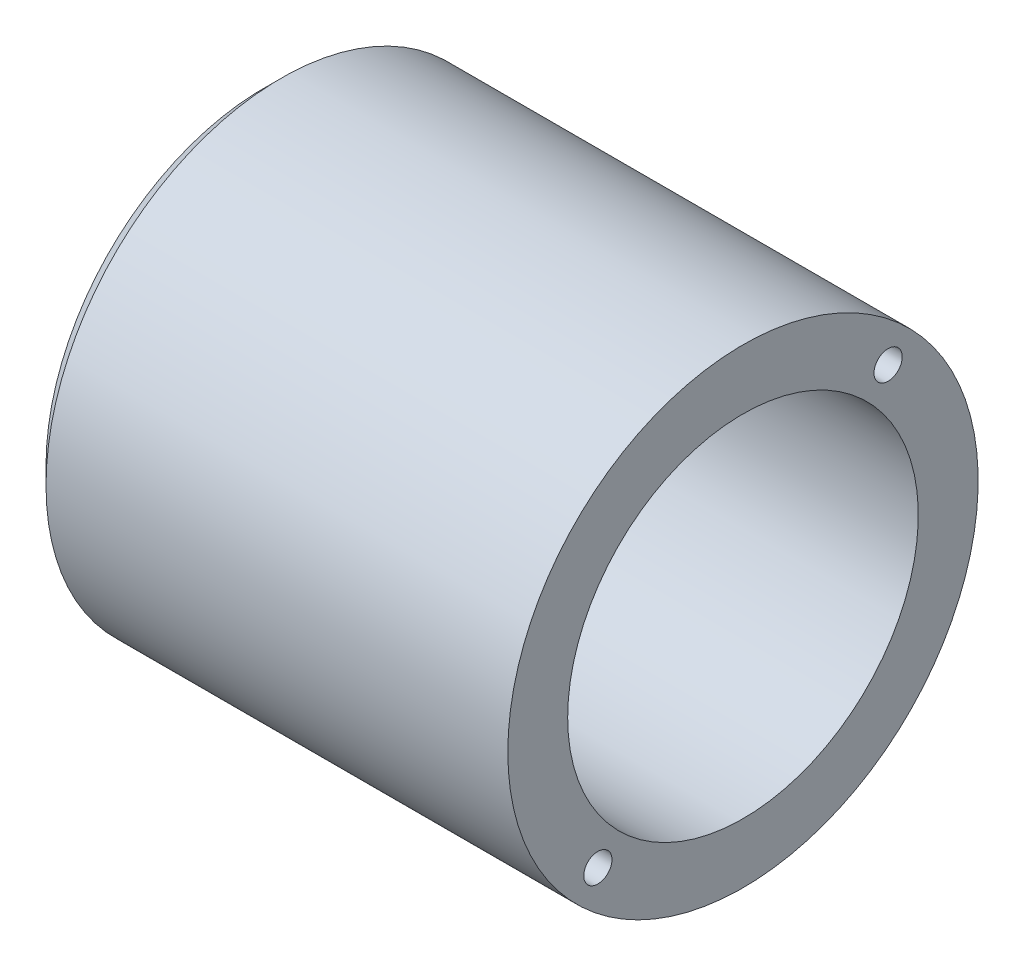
SolidWorks part; units mm, degrees
ref_plane "Vorne" through (0, 0, 0) normal (0, 0, 1) x (1, 0, 0)
ref_plane "Oben" through (0, 0, 0) normal (0, 1, 0) x (1, 0, 0)
ref_plane "Rechts" through (0, 0, 0) normal (1, 0, 0) x (0, 0, -1)
sketch "Skizze1" plane through (0, 0, 0) normal (0, 0, 1) x (1, 0, 0)
  line L0 (-8.3, 27.5) -> (47.7, 27.5) construction
  line L1 (47.7, 20.5) -> (-3.3, 20.5) construction
  line L2 (-8.3, 0) -> (-8.3, 27.5) construction
  line L3 (-3.3, 20.5) -> (-3.3, 0) construction
  line L4 (47.7, 16) -> (47.7, 27.5) construction
  line L5 (-8.3, 27.5) -> (47.7, 27.5)
  line L6 (47.7, 20.5) -> (-3.3, 20.5)
  line L7 (-8.3, 0) -> (-8.3, 27.5)
  line L8 (-3.3, 20.5) -> (-3.3, 0)
  line L9 (47.7, 20.5) -> (47.7, 27.5)
  line L10 (-200068.1765, 0) -> (200114.16, 0) construction
  line L11 (-200068.1765, 0) -> (200114.16, 0) construction
  line L12 (-8.3, 0) -> (-3.3, 0)
revolve "Rotation1" add sketch "Skizze1" angle 360 about L11
chamfer "Fase1" distance 2 angle 45 1 edges at (-8.3, 0, 27.5)
hole_wizard "M4 Gewindebohrung1" positions "Skizze3" profile "Skizze2" tap size "M4" standard "ISO"
sketch "Skizze3" plane through (47.7, 0, 0) normal (1, 0, 0) x (0, 0, -1)
  line L0 (0, 0) -> (16.9706, 16.9706) construction
  line L2 (0, 0) -> (0, 24) construction
  circle A0 centre (0, 0) radius 24 construction
  point P0 (16.9706, 16.9706)
  dimension "D1" = 48
  dimension "D2" = 45
sketch "Skizze2" plane through (47.7, 16.9706, -16.9706) normal (0, 1, 0) x (0, 0, -1)
  line L0 (0, 0) -> (0, 9.4914)
  line L1 (0, 9.4914) -> (1.65, 8.5)
  line L2 (1.65, 8.5) -> (1.65, 0)
  line L5 (1.65, 0) -> (0, 0)
  line L10 (0, 9.4914) -> (-1.65, 8.5) construction
  line L11 (0, -6.35) -> (0, 107.95) construction
  dimension "Bohrerdurchmesser" = 3.3
  dimension "Bohrungstiefe" = 8.5
  dimension "Spitzenwinkel" = 118
pattern_circular "Kreismuster1" count 2 over 360 about axis through (0, 0, 0) along (1, 0, 0) of "M4 Gewindebohrung1"
